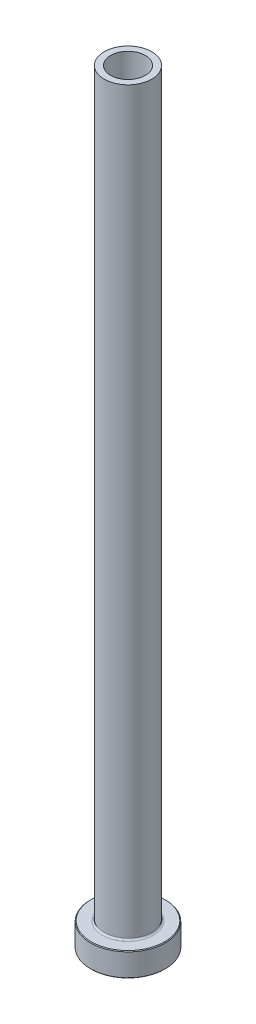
SolidWorks part; units mm, degrees
ref_plane "Front Plane" through (0, 0, 0) normal (0, 0, 1) x (1, 0, 0)
ref_plane "Top Plane" through (0, 0, 0) normal (0, 1, 0) x (1, 0, 0)
ref_plane "Right Plane" through (0, 0, 0) normal (1, 0, 0) x (0, 0, -1)
sketch "Sketch1" plane through (0, 0, 0) normal (0, 0, 1) x (1, 0, 0)
  line L0 (-5.1, 225) -> (-7, 225)
  line L1 (-7, 225) -> (-7, 7)
  line L2 (-7, 7) -> (-11, 7)
  line L3 (-11, 7) -> (-11, 0)
  line L4 (12.1, 0) -> (-12.1, 0) construction
  line L5 (-11, 0) -> (-5.35, 0)
  line L6 (-5.1, 170) -> (-5.1, 225)
  line L7 (0, 92.1877) -> (0, -15.5353) construction
  line L8 (0, -12.1) -> (0, 12.1) construction
  line L9 (-5.1, 170) -> (-5.35, 158)
  line L10 (-5.35, 158) -> (-5.35, 0)
  dimension "D1" = 0.25
  dimension "ID" = 10.2
  dimension "OD" = 14
  dimension "L" = 225
  dimension "H" = 22
  dimension "T" = 7
  dimension "N" = 55
  dimension "D2" = 12
revolve "Revolve1" add sketch "Sketch1" angle 360 about L7
fillet "Fillet1" radius 0.5 1 edges at (0, 7, 7)
chamfer "Chamfer1" distance 0.2 angle 45 2 edges at (0, 7, 11) (0, 0, 11)
chamfer "Chamfer3" distance 0.5 angle 45 1 edges at (0, 0, 5.35)
